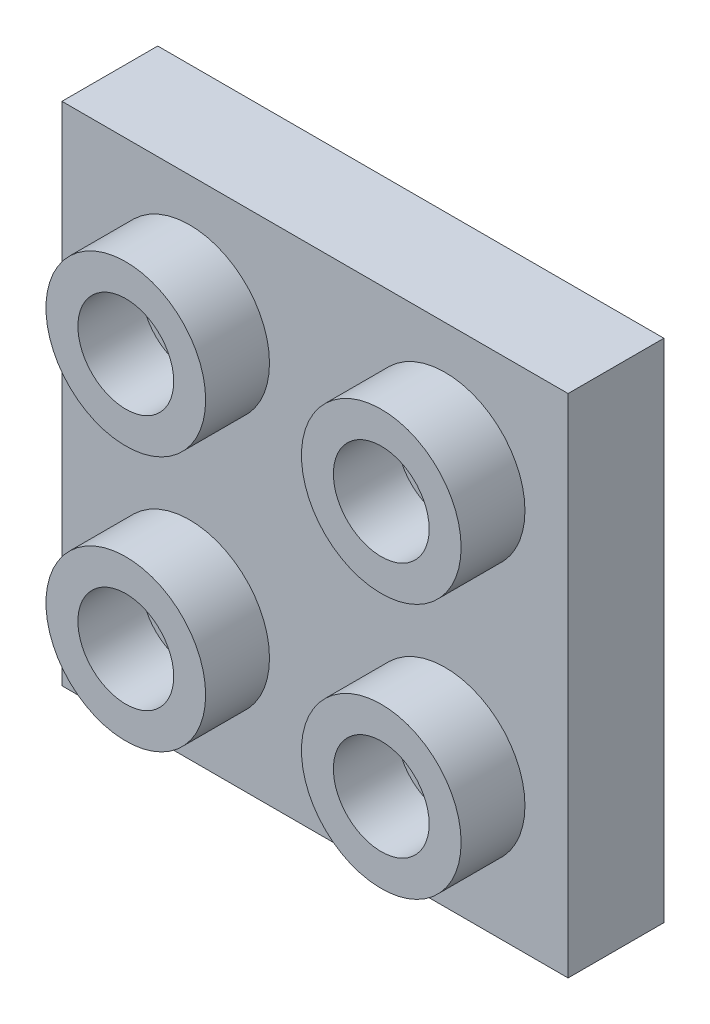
SolidWorks part; units mm, degrees
ref_plane "정면" through (0, 0, 0) normal (0, 0, 1) x (1, 0, 0)
ref_plane "윗면" through (0, 0, 0) normal (0, 1, 0) x (1, 0, 0)
ref_plane "우측면" through (0, 0, 0) normal (1, 0, 0) x (0, 0, -1)
sketch "스케치1" plane through (0.0073, -0.1313, 0) normal (0, 0, 1) x (1, 0, 0)
  line L1 (-8.5849, 7.9996) -> (7.2651, 7.9996)
  line L2 (-8.5849, 7.9996) -> (-8.5849, -7.8504)
  line L3 (-8.5849, -7.8504) -> (7.2651, -7.8504)
  line L4 (7.2651, 7.9996) -> (7.2651, -7.8504)
  dimension "D1" = 15.85
  dimension "D2" = 15.85
extrude "베이스돌출" add sketch "스케치1" against normal blind 3
sketch "스케치2" plane through (0, 0, 0) normal (0, 0, 1) x (1, 0, 0)
  line L0 (-8.5776, 7.8683) -> (-8.5776, -7.9817) construction
  line L1 (-8.5776, -7.9817) -> (7.2724, -7.9817) construction
  circle A0 centre (-4.5776, -3.9817) radius 2.5
  dimension "D1" = 5
  dimension "D2" = 4
  dimension "D3" = 4
extrude "보스-돌출1" add sketch "스케치2" along normal blind 2
pattern_linear "선형 패턴1" count 2 spacing 8 along (1, 0, 0) count 2 spacing 8 along (0, 1, 0) of "보스-돌출1"
sketch "스케치3" plane through (0, 0, -3) normal (0, 0, -1) x (-1, 0, 0)
  line L0 (8.5776, -7.9817) -> (-7.2724, -7.9817) construction
  line L1 (7.0776, -6.4817) -> (-5.7724, -6.4817)
  line L2 (7.0776, -6.4817) -> (7.0776, 6.3683)
  line L3 (7.0776, 6.3683) -> (-5.7724, 6.3683)
  line L4 (-5.7724, -6.4817) -> (-5.7724, 6.3683)
  line L5 (-7.2724, -7.9817) -> (-7.2724, 7.8683) construction
  line L6 (-7.2724, 7.8683) -> (8.5776, 7.8683) construction
  line L7 (8.5776, 7.8683) -> (8.5776, -7.9817) construction
  dimension "D1" = 1.5
  dimension "D2" = 1.5
  dimension "D3" = 1.5
  dimension "D4" = 1.5
extrude "컷-돌출1" cut sketch "스케치3" against normal blind 2
sketch "스케치4" plane through (0, -7.9817, 0) normal (0, -1, 0) x (1, 0, 0)
  line L0 (5.9224, 2) -> (0.9224, 2) construction
  line L1 (-8.5776, -3) -> (-8.5776, 0) construction
  line L2 (3.4224, -3.5) -> (3.4224, 0)
  line L3 (3.4224, 0) -> (-4.5776, 0)
  line L4 (-4.5776, -3.5) -> (-4.5776, 0)
  line L5 (-8.5776, 0) -> (7.2724, 0) construction
  arc A0 (-4.5776, -3.5) -> (3.4224, -3.5) centre (-0.5776, -3.5) ccw
  dimension "D1" = 4
  dimension "D2" = 5.5
  dimension "D3" = 8
extrude "Boss-Extrude1" add sketch "스케치4" against normal blind 7
sketch "스케치9" plane through (0, 0, 2) normal (0, 0, 1) x (1, 0, 0)
  circle A0 centre (-4.5776, -3.9817) radius 1.5
  circle A1 centre (-4.5776, -3.9817) radius 2.5 construction
  dimension "D1" = 3
extrude "컷-돌출6" cut sketch "스케치9" against normal up to vertex (2 mm away)
pattern_linear "선형 패턴2" count 2 spacing 8 along (0, 1, 0) count 2 spacing 8 along (1, 0, 0) of "컷-돌출6"
sketch "Sketch1" plane through (0, -7.9817, 0) normal (0, -1, 0) x (1, 0, 0)
  circle A0 centre (-0.5776, -3.5) radius 3
  dimension "D1" = 6
extrude "Cut-Extrude1" cut sketch "Sketch1" against normal blind 0.7
sketch "Sketch2" plane through (0, -7.2817, 0) normal (0, -1, 0) x (1, 0, 0)
  circle A0 centre (-0.5776, -3.5) radius 2.4
  dimension "D1" = 4.8
extrude "Cut-Extrude3" cut sketch "Sketch2" against normal blind 8.7
